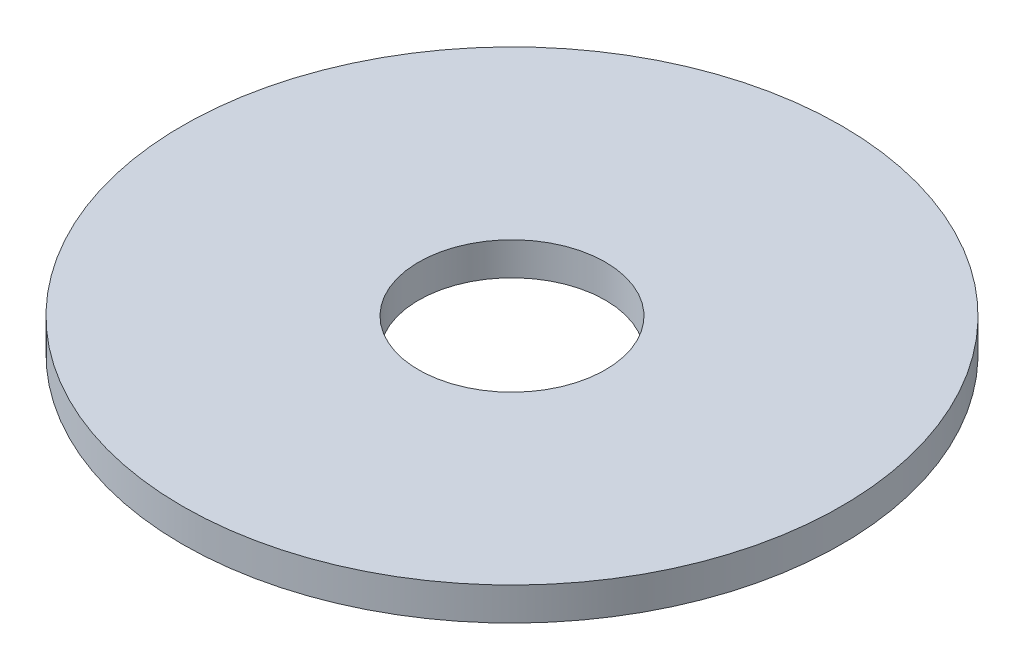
SolidWorks part; units mm, degrees
ref_plane "Plan1" through (0, 0, 0) normal (0, 0, 1) x (1, 0, 0)
ref_plane "Plan2" through (0, 0, 0) normal (0, 1, 0) x (1, 0, 0)
ref_plane "Plan3" through (0, 0, 0) normal (1, 0, 0) x (0, 0, -1)
sketch "Esquisse1" plane through (0, 0, 0) normal (0, 0, 1) x (1, 0, 0)
  line L0 (0, 0) -> (0, 50) construction
  line L1 (4.25, 0) -> (15, 0)
  line L2 (4.25, 0) -> (4.25, 1.5)
  line L3 (4.25, 1.5) -> (15, 1.5)
  line L4 (15, 0) -> (15, 1.5)
  dimension "D1" = 8.5
  dimension "D2" = 30
  dimension "D3" = 1.5
revolve "Base-Révolution" add sketch "Esquisse1" angle 360 about L0
